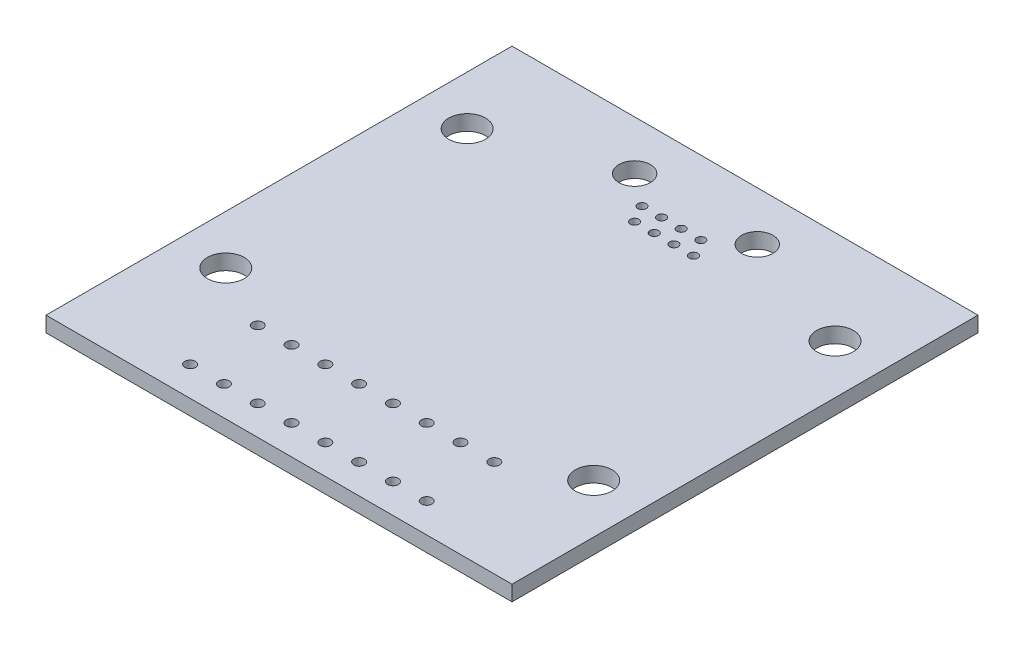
SolidWorks part; units mm, degrees
ref_plane "Front Plane" through (0, 0, 0) normal (0, 0, 1) x (1, 0, 0)
ref_plane "Top Plane" through (0, 0, 0) normal (0, 1, 0) x (1, 0, 0)
ref_plane "Right Plane" through (0, 0, 0) normal (1, 0, 0) x (0, 0, -1)
sketch "Sketch1" plane through (0, 0, 0) normal (0, 1, 0) x (1, 0, 0)
  line L0 (0, 0) -> (0, 48.26) construction
  line L1 (-24.13, 48.26) -> (24.13, 48.26)
  line L2 (-24.13, 48.26) -> (-24.13, 0)
  line L3 (-24.13, 0) -> (24.13, 0)
  line L4 (24.13, 48.26) -> (24.13, 0)
  circle A0 centre (-6.35, 43.18) radius 1.6256
  circle A1 centre (-19.05, 38.5343) radius 1.905
  circle A2 centre (-19.05, 13.5382) radius 1.905
  circle A3 centre (-12.25, 10.0482) radius 0.55
  circle A4 centre (-12.25, 3.048) radius 0.55
  circle A5 centre (-8.75, 3.048) radius 0.55
  circle A6 centre (-8.75, 10.0482) radius 0.55
  circle A7 centre (-5.25, 3.048) radius 0.55
  circle A8 centre (-5.25, 10.0482) radius 0.55
  circle A9 centre (-1.75, 10.0482) radius 0.55
  circle A10 centre (-1.75, 3.048) radius 0.55
  circle A11 centre (-3.048, 40.64) radius 0.4445
  circle A12 centre (-1.016, 40.64) radius 0.4445
  circle A13 centre (1.016, 40.64) radius 0.4445
  circle A14 centre (3.048, 40.64) radius 0.4445
  circle A15 centre (-2.032, 38.862) radius 0.4445
  circle A16 centre (0, 38.862) radius 0.4445
  circle A17 centre (2.032, 38.862) radius 0.4445
  circle A18 centre (4.064, 38.862) radius 0.4445
  circle A19 centre (6.35, 43.18) radius 1.6256
  circle A20 centre (19.05, 38.5343) radius 1.905
  circle A21 centre (19.05, 13.5382) radius 1.905
  circle A22 centre (12.25, 10.0482) radius 0.55
  circle A23 centre (8.75, 10.0482) radius 0.55
  circle A24 centre (5.25, 10.0482) radius 0.55
  circle A25 centre (1.75, 10.0482) radius 0.55
  circle A26 centre (1.75, 3.048) radius 0.55
  circle A27 centre (5.25, 3.048) radius 0.55
  circle A28 centre (8.75, 3.048) radius 0.55
  circle A29 centre (12.25, 3.048) radius 0.55
  point P4 (0, 0)
  dimension "D3" = 1.1
  dimension "D5" = 3.5
  dimension "D6" = 3.5
  dimension "D7" = 3.5
  dimension "D8" = 3.048
  dimension "D9" = 10.0482
  dimension "D10" = 13.5382
  dimension "D12" = 3.81
  dimension "D15" = 43.18
  dimension "D16" = 3.2512
  dimension "D17" = 0.889
  dimension "D19" = 2.032
  dimension "D20" = 2.032
  dimension "D21" = 3.048
  dimension "D23" = 1.016
  dimension "D25" = 38.862
  dimension "D26" = 40.64
  dimension "D1" = 48.26
  dimension "D2" = 24.13
  dimension "D4" = 1.75
  dimension "D11" = 38.5343
  dimension "D13" = 19.05
  dimension "D14" = 6.35
  dimension "D18" = 4.064
  dimension "D22" = 1.016
  dimension "D24" = 3.048
extrude "Boss-Extrude1" add sketch "Sketch1" along normal blind 1.5875
